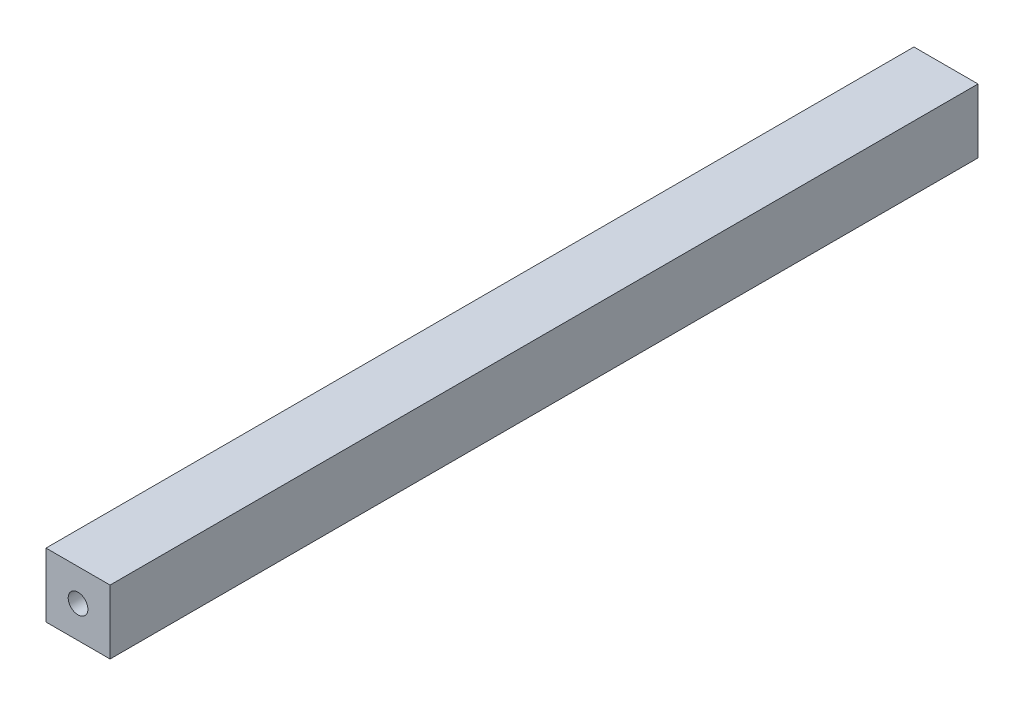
SolidWorks part; units mm, degrees
ref_plane "Plan1" through (0, 0, 0) normal (0, 0, 1) x (1, 0, 0)
ref_plane "Plan2" through (0, 0, 0) normal (0, 1, 0) x (1, 0, 0)
ref_plane "Plan3" through (0, 0, 0) normal (1, 0, 0) x (0, 0, -1)
sketch "Esquisse1" plane through (0, 0, 0) normal (0, 0, 1) x (1, 0, 0)
  line L1 (0, 0) -> (22, 0)
  line L2 (0, 0) -> (0, 22)
  line L3 (0, 22) -> (22, 22)
  line L4 (22, 0) -> (22, 22)
  dimension "D1" = 22
  dimension "D2" = 22
extrude "Base-Extrusion" add sketch "Esquisse1" along normal blind 298
sketch "Esquisse2" plane through (0, 0, 298) normal (0, 0, 1) x (1, 0, 0)
  line L0 (0, 0) -> (22, 0) construction
  line L1 (0, 22) -> (0, 0) construction
  circle A0 centre (11, 11) radius 3.375
  dimension "D1" = 6.75
  dimension "D2" = 11
  dimension "D3" = 11
extrude "Enlèv. mat.-Extru.1" cut sketch "Esquisse2" against normal blind 25
sketch "Esquisse3" plane through (0, 0, 0) normal (0, 0, -1) x (-1, 0, 0)
  line L0 (-22, 22) -> (0, 22) construction
  line L1 (0, 22) -> (0, 0) construction
  circle A0 centre (-11, 11) radius 3.375
  dimension "D1" = 6.75
  dimension "D2" = 11
  dimension "D3" = 11
extrude "Enlèv. mat.-Extru.2" cut sketch "Esquisse3" against normal blind 25
